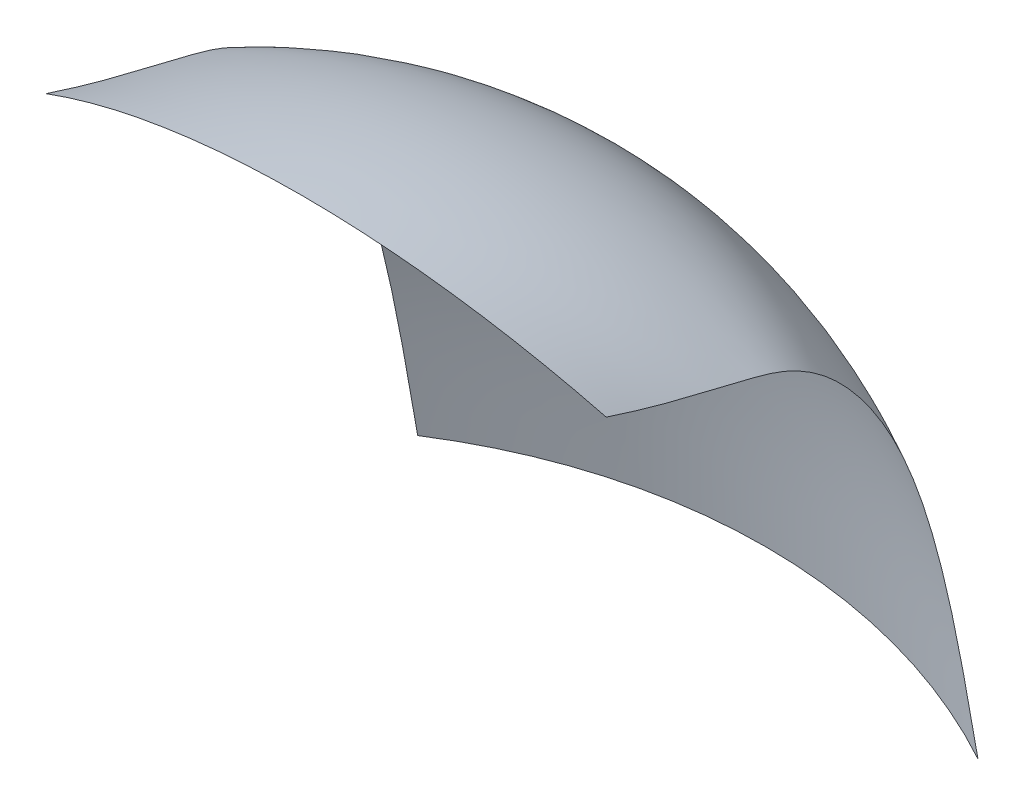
SolidWorks part; units mm, degrees
ref_plane "Front Plane" through (0, 0, 0) normal (0, 0, 1) x (1, 0, 0)
ref_plane "Top Plane" through (0, 0, 0) normal (0, 1, 0) x (1, 0, 0)
ref_plane "Right Plane" through (0, 0, 0) normal (1, 0, 0) x (0, 0, -1)
sketch "Path - Back Face" plane through (0, 0, 0) normal (1, 0, 0) x (0, 0, -1)
  arc A0 (114.6677, -23.7382) -> (50.5228, 132.4857) centre (-226.9104, -72.708) ccw construction
  arc A1 (50.5228, 132.4857) -> (-44.66, 160.4198) centre (-15.4983, 83.6556) ccw construction
  spline S0 degree 3 poles (114.6677, -23.7382) (106.514, 33.1362) (84.6912, 86.2865) (50.5262, 132.4811) (50.5254, 132.4821) (50.5239, 132.4842) (50.5216, 132.4873) (50.5201, 132.4894) (50.5193, 132.4904) (27.7785, 163.2326) (-8.9135, 173.9995) (-44.66, 160.4198) knots 0 0 0 0 0.629944 0.629944 0.629944 0.629958 0.629973 0.629987 0.629987 0.629987 1 1 1 1 weights 1 0.979733 0.979733 1 1 1 1 1 1 0.86467 0.86467 1
ref_plane "Plane1" through (0, -23.7382, -114.6677) normal (0, 0.9899, 0.1419) x (-1, 0, 0)
sketch "Profile - Back Face" plane through (0, -23.7382, -114.6677) normal (0, 0.9899, 0.1419) x (-1, 0, 0)
  line L0 (0, 0) -> (0, 80.992) construction
  arc A0 (-96.1745, 23.5747) -> (96.1745, 23.5747) centre (0, 207.9626) ccw
surface "Surface-Sweep1"
ref_plane "Plane2" through (0, 201.5636, 0) normal (0, 1, 0) x (-1, 0, 0)
ref_plane "Plane3" through (0, -117.7192, 0) normal (0, 1, 0) x (-1, 0, 0)
sketch "Sketch3" plane through (0, -117.7192, 0) normal (0, 1, 0) x (1, 0, 0)
  line L0 (0, 0) -> (0, -27.3284) construction
  arc A0 (-130.2009, 0.0782) -> (130.2009, 0.0782) centre (0, 295.6482) ccw
sketch "Sketch4" plane through (0, 201.5636, 0) normal (0, 1, 0) x (-1, 0, 0)
  line L0 (0, 0) -> (0, -70.6245) construction
  arc A0 (-128.7139, -65.0444) -> (128.7139, -65.0444) centre (0, -203.3765) cw
